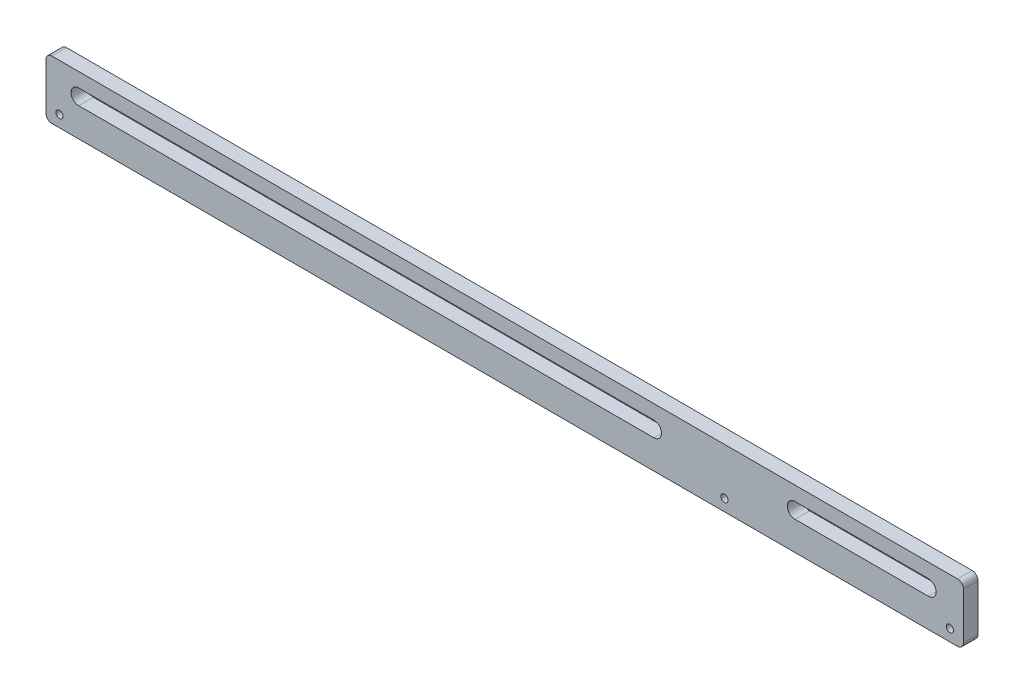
SolidWorks part; units mm, degrees
ref_plane "Front Plane" through (0, 0, 0) normal (0, 0, 1) x (1, 0, 0)
ref_plane "Top Plane" through (0, 0, 0) normal (0, 1, 0) x (1, 0, 0)
ref_plane "Right Plane" through (0, 0, 0) normal (1, 0, 0) x (0, 0, -1)
sketch "Sketch1" plane through (0, 0, 0) normal (0, 0, 1) x (1, 0, 0)
  line L0 (0, 15.875) -> (398.78, 15.875) construction
  line L1 (0, 0) -> (398.78, 0)
  line L2 (0, 0) -> (0, 25.4)
  line L3 (0, 25.4) -> (398.78, 25.4)
  line L4 (398.78, 0) -> (398.78, 25.4)
  line L5 (14.224, 15.875) -> (264.224, 15.875) construction
  line L6 (14.224, 19.215) -> (264.224, 19.215)
  line L7 (14.224, 12.535) -> (264.224, 12.535)
  line L8 (325.58, 15.875) -> (383.58, 15.875) construction
  line L9 (325.58, 19.215) -> (383.58, 19.215)
  line L10 (325.58, 12.535) -> (383.58, 12.535)
  arc A0 (14.224, 19.215) -> (14.224, 12.535) centre (14.224, 15.875) ccw
  arc A1 (264.224, 12.535) -> (264.224, 19.215) centre (264.224, 15.875) ccw
  arc A2 (325.58, 19.215) -> (325.58, 12.535) centre (325.58, 15.875) ccw
  arc A3 (383.58, 12.535) -> (383.58, 19.215) centre (383.58, 15.875) ccw
  point P9 (139.224, 15.875)
  point P16 (354.58, 15.875)
  dimension "D1" = 25.4
  dimension "D2" = 398.78
  dimension "D3" = 9.525
  dimension "D4" = 6.68
  dimension "D5" = 14.224
  dimension "D6" = 250
  dimension "D7" = 6.68
  dimension "D8" = 15.2
  dimension "D9" = 58
extrude "Boss-Extrude1" add sketch "Sketch1" along normal blind 6.35
fillet "Fillet1" radius 2.54 4 edges at (0, 0, 3.175) (398.78, 0, 3.175) (398.78, 25.4, 3.175) (0, 25.4, 3.175)
sketch "Sketch2" plane through (0, 0, 6.35) normal (0, 0, 1) x (1, 0, 0)
  circle A0 centre (294.9598, 5.08) radius 1.575
  circle A1 centre (392.9141, 5.08) radius 1.575
  circle A2 centre (5.8659, 5.08) radius 1.575
  dimension "D1" = 3.15
extrude "Cut-Extrude1" cut sketch "Sketch2" against normal blind 6.35
